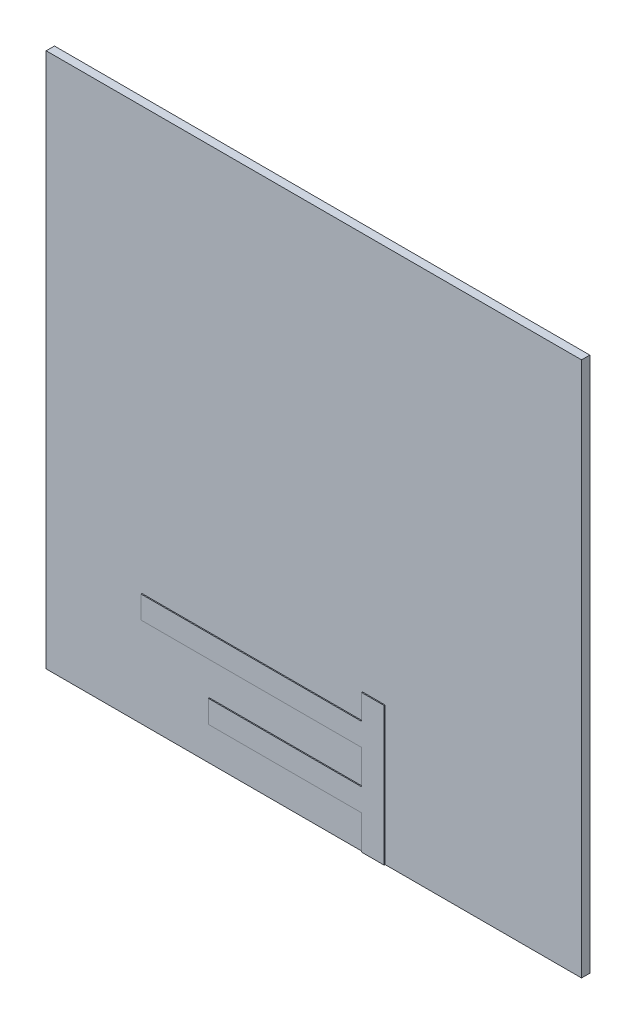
SolidWorks part; units mm, degrees
ref_plane "Alzado" through (0, 0, 0) normal (0, 0, 1) x (1, 0, 0)
ref_plane "Planta" through (0, 0, 0) normal (0, 1, 0) x (1, 0, 0)
ref_plane "Vista lateral" through (0, 0, 0) normal (1, 0, 0) x (0, 0, -1)
sketch "Croquis1" plane through (0, 0, 0) normal (0, 0, 1) x (1, 0, 0)
  line L0 (55, 0) -> (-55, 0) construction
  line L1 (-55, 55) -> (55, 55)
  line L2 (-55, 55) -> (-55, -55)
  line L3 (-55, -55) -> (55, -55)
  line L4 (55, 55) -> (55, -55)
  line L5 (0, -55) -> (0, 55) construction
  dimension "D1" = 110
  dimension "D2" = 110
  dimension "D3" = 55
  dimension "D4" = 55
extrude "Saliente-Extruir1" add sketch "Croquis1" along normal blind 1.9
sketch "Croquis7" plane through (0, 0, 1.9) normal (0, 0, 1) x (1, 0, 0)
  line L0 (14.63, -55) -> (14.63, -26.5961)
  line L1 (-55, -55) -> (55, -55) construction
  line L2 (14.63, -26.5961) -> (10, -26.5961)
  line L3 (10, -26.5961) -> (10, -31.735)
  line L4 (10, -31.735) -> (-35.33, -31.735)
  line L5 (-35.33, -31.735) -> (-35.33, -36.365)
  line L6 (-35.33, -36.365) -> (10, -36.365)
  line L7 (10, -36.365) -> (10, -43.375)
  line L8 (10, -43.375) -> (-21.48, -43.375)
  line L9 (-21.48, -43.375) -> (-21.48, -48.005)
  line L10 (-21.48, -48.005) -> (10, -48.005)
  line L11 (10, -48.005) -> (10, -55)
  line L12 (10, -55) -> (14.63, -55)
  line L13 (0, -1.045) -> (0, 1.045) construction
  point P4 (-21.48, -45.69)
  point P15 (-35.33, -34.05)
  dimension "D1" = 31.48
  dimension "D2" = 4.63
  dimension "D3" = 4.63
  dimension "D4" = 9.31
  dimension "D5" = 20.95
  dimension "D6" = 31.48
  dimension "D7" = 45.33
  dimension "D8" = 4.63
  dimension "D9" = 4.63
  dimension "D10" = 10
sketch "Croquis9" plane through (0, 0, 1.9) normal (0, 0, 1) x (1, 0, 0)
  line L0 (10, -55) -> (-55, -55)
  line L1 (-55, -55) -> (-55, 55)
  line L2 (-55, 55) -> (55, 55)
  line L3 (55, 55) -> (55, -55)
  line L4 (55, -55) -> (14.63, -55)
  line L5 (14.63, -55) -> (14.63, -26.5961)
  line L6 (14.63, -26.5961) -> (10, -26.5961)
  line L7 (10, -26.5961) -> (10, -31.735)
  line L8 (10, -31.735) -> (-35.33, -31.735)
  line L9 (-35.33, -31.735) -> (-35.33, -36.365)
  line L10 (-35.33, -36.365) -> (10, -36.365)
  line L11 (10, -36.365) -> (10, -43.375)
  line L12 (10, -43.375) -> (-21.48, -43.375)
  line L13 (-21.48, -43.375) -> (-21.48, -48.005)
  line L14 (-21.48, -48.005) -> (10, -48.005)
  line L15 (10, -48.005) -> (10, -55)
extrude "Cortar-Extruir1" cut sketch "Croquis9" against normal blind 0.2
